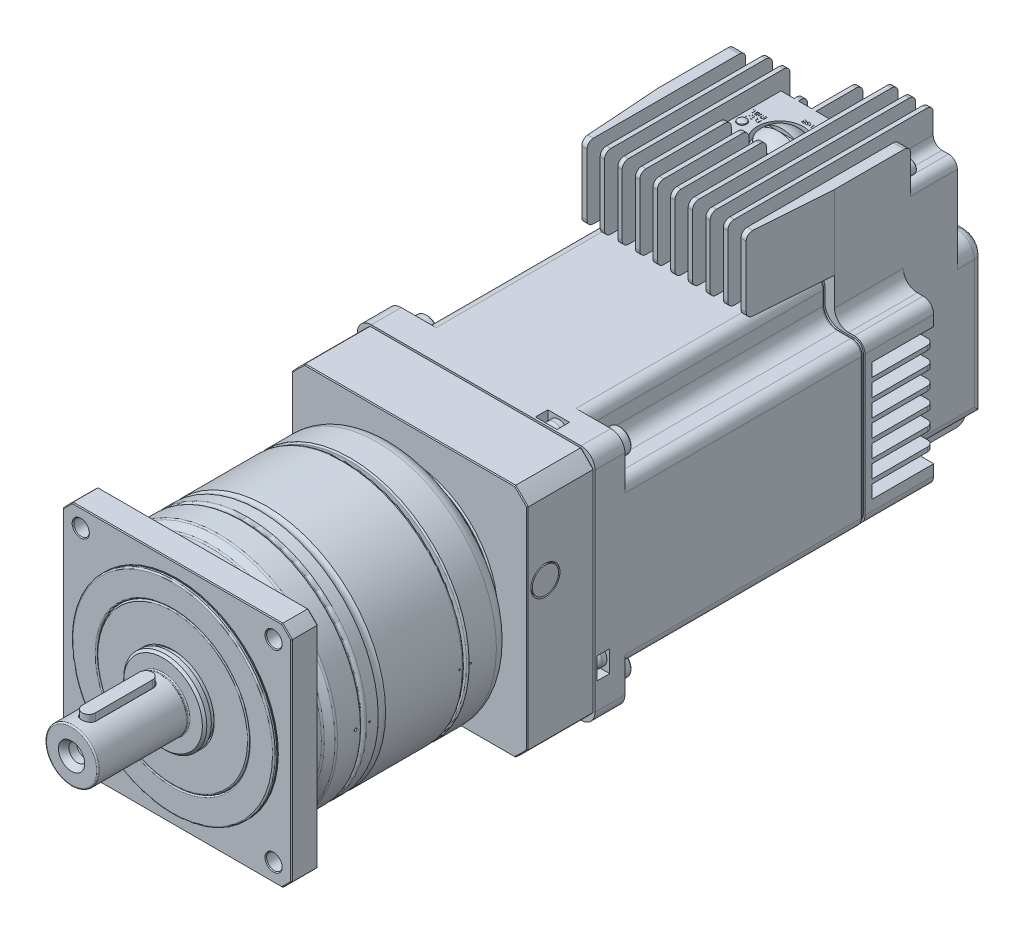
SolidWorks part; units mm, degrees
ref_plane "Front Plane" through (0, 0, 0) normal (0, 0, 1) x (1, 0, 0)
ref_plane "Top Plane" through (0, 0, 0) normal (0, 1, 0) x (1, 0, 0)
ref_plane "Right Plane" through (0, 0, 0) normal (1, 0, 0) x (0, 0, -1)
imported_body "Imported1"
imported_body "Imported2"
imported_body "Imported3"
sketch "Sketch1" plane through (0, 0, -9.525) normal (0, 0, -1) x (-1, 0, 0)
  line L4 (40.975, -37.7298) -> (40.975, 37.7298)
  line L5 (37.7298, 40.975) -> (-37.7298, 40.975)
  line L6 (-40.975, 37.7298) -> (-40.975, -37.7298)
  line L7 (-37.7298, -40.975) -> (37.7298, -40.975)
  line L8 (40.975, -37.7298) -> (40.975, 37.7298)
  line L9 (37.7298, 40.975) -> (-37.7298, 40.975)
  line L10 (-40.975, 37.7298) -> (-40.975, -37.7298)
  line L11 (-37.7298, -40.975) -> (37.7298, -40.975)
  arc A4 (40.975, 37.7298) -> (37.7298, 40.975) centre (0, 0) ccw
  arc A5 (-37.7298, 40.975) -> (-40.975, 37.7298) centre (0, 0) ccw
  arc A6 (-40.975, -37.7298) -> (-37.7298, -40.975) centre (0, 0) ccw
  arc A7 (37.7298, -40.975) -> (40.975, -37.7298) centre (0, 0) ccw
  arc A8 (40.975, 37.7298) -> (37.7298, 40.975) centre (0, 0) ccw
  arc A9 (-37.7298, 40.975) -> (-40.975, 37.7298) centre (0, 0) ccw
  arc A10 (-40.975, -37.7298) -> (-37.7298, -40.975) centre (0, 0) ccw
  arc A11 (37.7298, -40.975) -> (40.975, -37.7298) centre (0, 0) ccw
  dimension "D1" = 0
extrude "Cut-Extrude1" cut sketch "Sketch1" along normal blind 0.0025
sketch "Sketch2" plane through (0, 0, -83.9) normal (0, 0, 1) x (1, 0, 0)
  line L4 (37.8688, 42.2) -> (-37.8688, 42.2)
  line L5 (-42.2, 37.8688) -> (-42.2, -37.8688)
  line L6 (-37.8688, -42.2) -> (37.8688, -42.2)
  line L7 (42.2, -37.8688) -> (42.2, 37.8688)
  line L8 (37.8688, 42.2) -> (-37.8688, 42.2)
  line L9 (-42.2, 37.8688) -> (-42.2, -37.8688)
  line L10 (-37.8688, -42.2) -> (37.8688, -42.2)
  line L11 (42.2, -37.8688) -> (42.2, 37.8688)
  arc A4 (-37.8688, 42.2) -> (-42.2, 37.8688) centre (0, 0) ccw
  arc A5 (-42.2, -37.8688) -> (-37.8688, -42.2) centre (0, 0) ccw
  arc A6 (37.8688, -42.2) -> (42.2, -37.8688) centre (0, 0) ccw
  arc A7 (42.2, 37.8688) -> (37.8688, 42.2) centre (0, 0) ccw
  arc A8 (-37.8688, 42.2) -> (-42.2, 37.8688) centre (0, 0) ccw
  arc A9 (-42.2, -37.8688) -> (-37.8688, -42.2) centre (0, 0) ccw
  arc A10 (37.8688, -42.2) -> (42.2, -37.8688) centre (0, 0) ccw
  arc A11 (42.2, 37.8688) -> (37.8688, 42.2) centre (0, 0) ccw
  dimension "D1" = 0
extrude "Cut-Extrude2" cut sketch "Sketch2" along normal blind 0.0025
delete or keep bodies "Body-Delete/Keep 2" [suppressed] type delete bodies bodies 107 105 104 101
